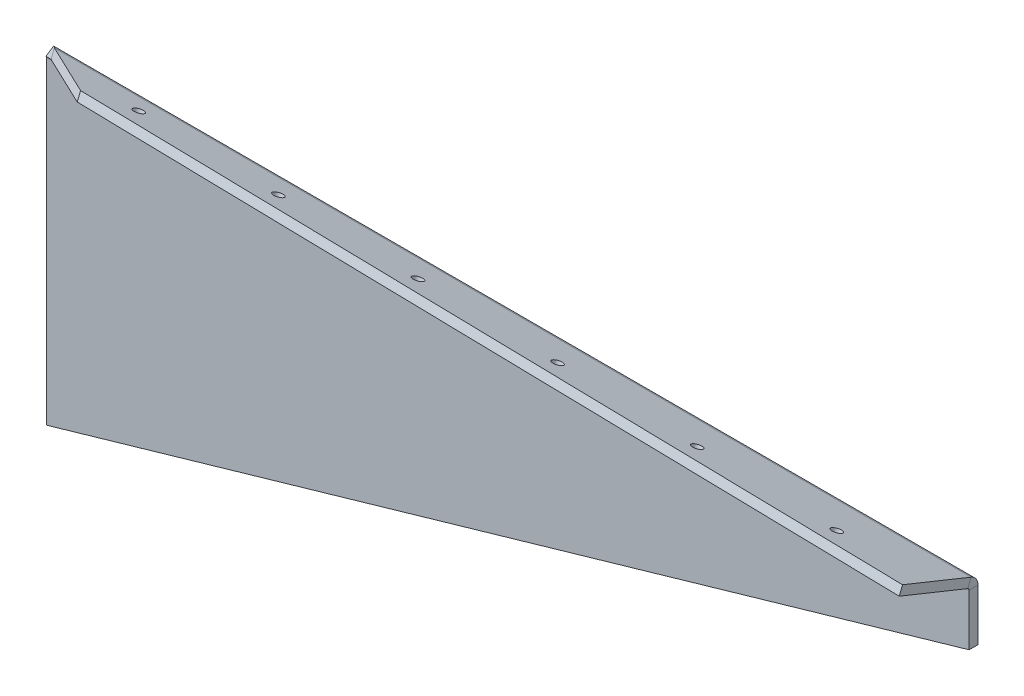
SolidWorks part; units mm, degrees
ref_plane "前视基准面" through (0, 0, 0) normal (0, 0, 1) x (1, 0, 0)
ref_plane "上视基准面" through (0, 0, 0) normal (0, 1, 0) x (1, 0, 0)
ref_plane "右视基准面" through (0, 0, 0) normal (1, 0, 0) x (0, 0, -1)
sketch "草图1" plane through (0, 0, 0) normal (0, 0, 1) x (1, 0, 0)
  line L0 (0, 0) -> (0, -290)
  line L1 (0, 0) -> (830, 0) construction
  line L2 (830, 70) -> (830, -50)
  line L3 (0, -290) -> (830, -50)
  line L4 (830, 70) -> (64.9576, 42.3479)
  line L5 (64.9576, 42.3479) -> (0, 0)
  point P0 (0, 40)
  dimension "D1" = 330
  dimension "D2" = 40
  dimension "D3" = 830
  dimension "D4" = 70
  dimension "D5" = 120
  dimension "D6" = 40
  dimension "D7" = 65
sheet metal parameters "钣金1" thickness 8 parameters "D1"=2
base flange "基体-法兰1" sketch "草图1" thickness 8 reverse thickness direction yes parameters "D1"=2
sketch "草图3" plane through (0, 0, 0) normal (0, 0, -1) x (-1, 0, 0)
  line L0 (0, 0) -> (-913.9229, 0)
sketched bend "绘制的折弯1" parameters "D1"=2
bend "草图折弯1" bend radius 2 bend angle 68 parameters "D5"=1
sketch "草图4" plane through (0, -4.6798, 1.8907) normal (0, -0.9272, 0.3746) x (1, 0, 0)
  line L0 (0, 6.8197) -> (0, 2.3461) construction
  line L1 (830, 74.3776) -> (64.9576, 46.7255) construction
  circle A0 centre (100, 27.979) radius 4.5
  point P2 (0, 4.5829)
  dimension "D1" = 9
  dimension "D2" = 100
  dimension "D3" = 20
extrude "拉伸1" cut sketch "草图4" against normal blind 10
pattern_linear "阵列(线性)1" count 6 spacing 130 along (0.9993, 0.0135, 0.0335) of "拉伸1"
flat pattern "平板型式1"
sketch "折弯-线1" plane through (0, 0, 0) normal (0, 1, 0) x (-1, 0, 0)
bend of the flat pattern "展开-<草图折弯1>1"
